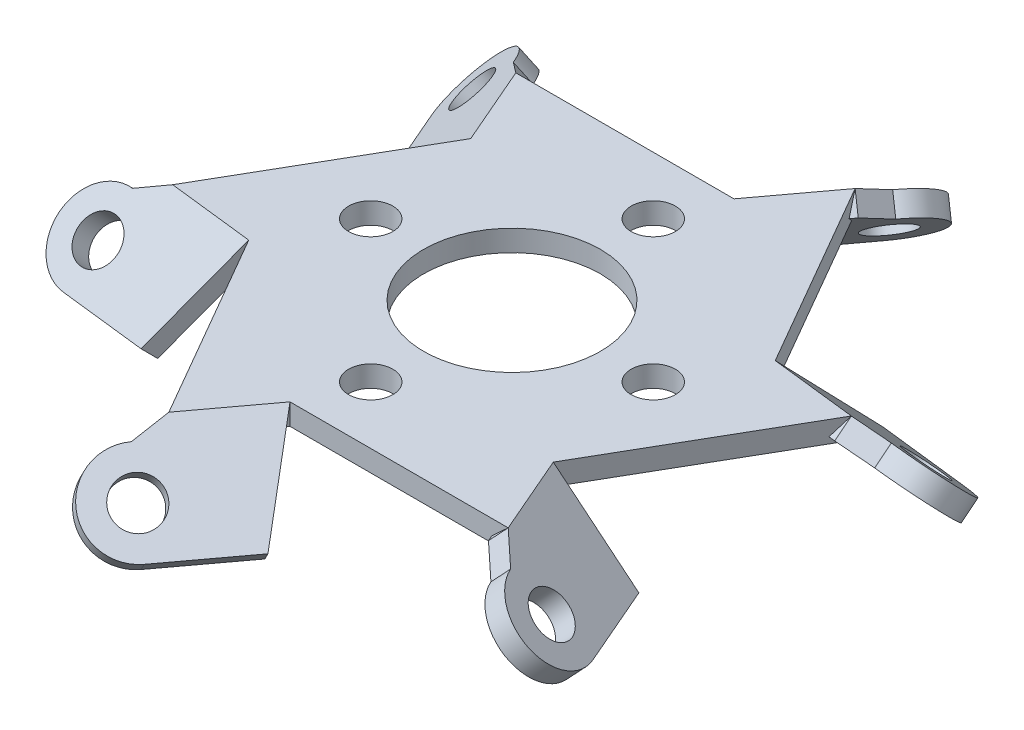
SolidWorks part; units mm, degrees
other "<MecanumHub - (Bottom).0003>-<Imported1>"
ref_plane "Front Plane" through (0, 0, 0) normal (0, 0, 1) x (1, 0, 0)
ref_plane "Top Plane" through (0, 0, 0) normal (0, 1, 0) x (1, 0, 0)
ref_plane "Right Plane" through (0, 0, 0) normal (1, 0, 0) x (0, 0, -1)
mirrored part "MecanumHub - (Bottom).0003_Mirrored"
ref_plane "Plane1" through (0, -12.0593, 0) normal (0, 1, 0) x (1, 0, 0)
